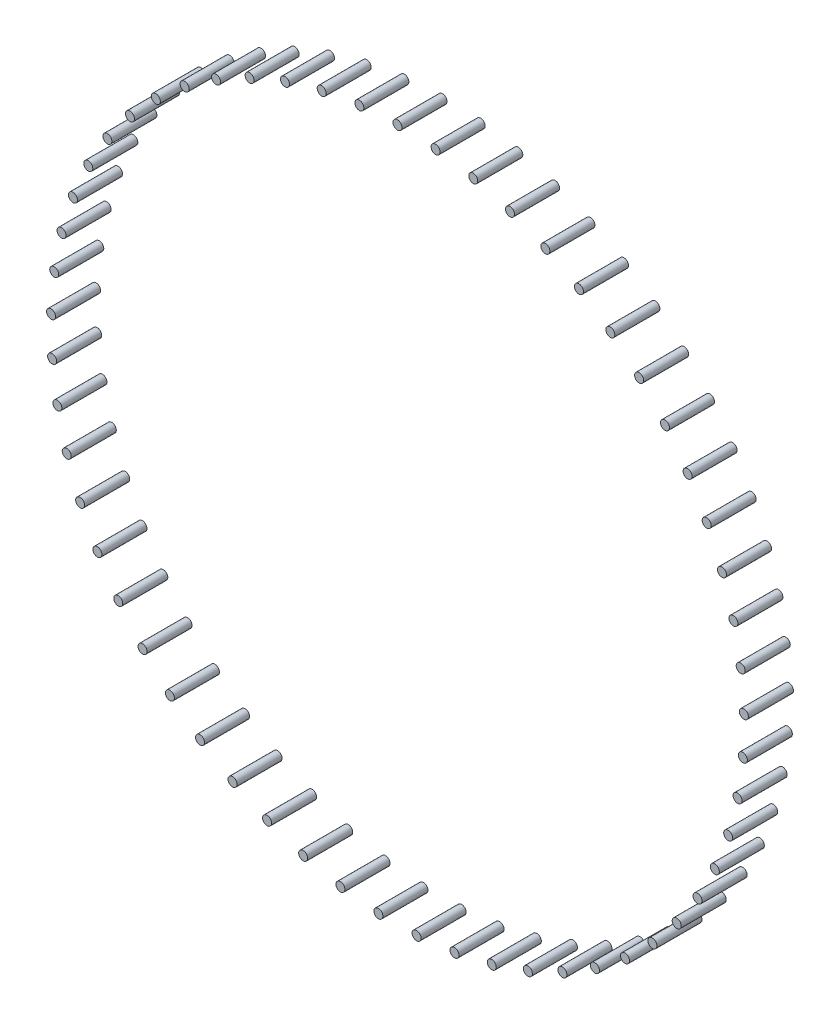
SolidWorks part; units mm, degrees
ref_plane "Plan de face" through (0, 0, 0) normal (0, 0, 1) x (1, 0, 0)
ref_plane "Plan de dessus" through (0, 0, 0) normal (0, 1, 0) x (1, 0, 0)
ref_plane "Plan de droite" through (0, 0, 0) normal (1, 0, 0) x (0, 0, -1)
sketch "Esquisse1" plane through (0, 0, 0) normal (0, 0, 1) x (1, 0, 0)
  line L0 (0, 0) -> (0, 174.6605) construction
  line L1 (0, 0) -> (19.2141, 173.6004) construction
  line L2 (0, 0) -> (38.1949, 170.4331) construction
  line L3 (0, 0) -> (56.7122, 165.1969) construction
  line L4 (0, 0) -> (74.541, 157.9555) construction
  line L5 (0, 0) -> (91.465, 148.7967) construction
  line L6 (0, 0) -> (107.2787, 137.8317) construction
  line L7 (0, 0) -> (121.7902, 125.1936) construction
  line L8 (0, 0) -> (134.8233, 111.0358) construction
  line L9 (0, 0) -> (146.2199, 95.5302) construction
  line L10 (0, 0) -> (155.8416, 78.865) construction
  line L11 (0, 0) -> (163.5715, 61.2425) construction
  line L12 (0, 0) -> (169.3159, 42.8766) construction
  line L13 (0, 0) -> (173.0051, 23.9902) construction
  line L14 (0, 0) -> (174.5942, 4.8127) construction
  line L15 (0, 0) -> (174.0639, -14.4233) construction
  line L16 (0, 0) -> (171.4208, -33.4843) construction
  line L17 (0, 0) -> (166.6969, -52.1387) construction
  line L18 (0, 0) -> (159.9494, -70.1603) construction
  line L19 (0, 0) -> (151.2604, -87.3303) construction
  line L20 (0, 0) -> (140.7353, -103.4401) construction
  line L21 (0, 0) -> (128.5019, -118.2943) construction
  line L22 (0, 0) -> (114.7086, -131.7126) construction
  line L23 (0, 0) -> (99.523, -143.5321) construction
  line L24 (0, 0) -> (83.1292, -153.6093) construction
  line L25 (0, 0) -> (65.7264, -161.8219) construction
  line L26 (0, 0) -> (47.5257, -168.0702) construction
  line L27 (0, 0) -> (28.7482, -172.2784) construction
  line L28 (0, 0) -> (9.6217, -174.3953) construction
  line L29 (0, 0) -> (-9.6217, -174.3953) construction
  line L30 (0, 0) -> (-28.7482, -172.2784) construction
  line L31 (0, 0) -> (-47.5257, -168.0702) construction
  line L32 (0, 0) -> (-65.7264, -161.8219) construction
  line L33 (0, 0) -> (-83.1292, -153.6093) construction
  line L34 (0, 0) -> (-99.523, -143.5321) construction
  line L35 (0, 0) -> (-114.7086, -131.7126) construction
  line L36 (0, 0) -> (-128.5019, -118.2943) construction
  line L37 (0, 0) -> (-140.7353, -103.4401) construction
  line L38 (0, 0) -> (-151.2604, -87.3302) construction
  line L39 (0, 0) -> (-159.9494, -70.1603) construction
  line L40 (0, 0) -> (-166.6969, -52.1387) construction
  line L41 (0, 0) -> (-171.4208, -33.4843) construction
  line L42 (0, 0) -> (-174.0639, -14.4233) construction
  line L43 (0, 0) -> (-174.5942, 4.8127) construction
  line L44 (0, 0) -> (-173.0051, 23.9902) construction
  line L45 (0, 0) -> (-169.3159, 42.8766) construction
  line L46 (0, 0) -> (-163.5715, 61.2425) construction
  line L47 (0, 0) -> (-155.8416, 78.865) construction
  line L48 (0, 0) -> (-146.2199, 95.5302) construction
  line L49 (0, 0) -> (-134.8233, 111.0358) construction
  line L50 (0, 0) -> (-121.7902, 125.1936) construction
  line L51 (0, 0) -> (-107.2787, 137.8317) construction
  line L52 (0, 0) -> (-91.465, 148.7967) construction
  line L53 (0, 0) -> (-74.541, 157.9555) construction
  line L54 (0, 0) -> (-56.7122, 165.1969) construction
  line L55 (0, 0) -> (-38.1949, 170.4331) construction
  line L56 (0, 0) -> (-19.2141, 173.6004) construction
  circle A0 centre (0, 0) radius 174.6605 construction
  circle A1 centre (-83.1292, -153.6093) radius 2.269
  circle A2 centre (-99.523, -143.5321) radius 2.269
  circle A3 centre (-114.7086, -131.7126) radius 2.269
  circle A4 centre (-128.5019, -118.2943) radius 2.269
  circle A5 centre (-140.7353, -103.4401) radius 2.269
  circle A6 centre (-151.2604, -87.3303) radius 2.269
  circle A7 centre (-159.9494, -70.1603) radius 2.269
  circle A8 centre (-166.6969, -52.1387) radius 2.269
  circle A9 centre (-171.4208, -33.4843) radius 2.269
  circle A10 centre (-174.0639, -14.4233) radius 2.269
  circle A11 centre (-174.5942, 4.8127) radius 2.269
  circle A12 centre (-173.0051, 23.9902) radius 2.269
  circle A13 centre (-169.3159, 42.8766) radius 2.269
  circle A14 centre (-163.5715, 61.2425) radius 2.269
  circle A15 centre (-155.8416, 78.865) radius 2.269
  circle A16 centre (-146.2199, 95.5302) radius 2.269
  circle A17 centre (-134.8233, 111.0358) radius 2.269
  circle A18 centre (-121.7902, 125.1936) radius 2.269
  circle A19 centre (-107.2787, 137.8317) radius 2.269
  circle A20 centre (-91.465, 148.7967) radius 2.269
  circle A21 centre (-74.541, 157.9555) radius 2.269
  circle A22 centre (-56.7122, 165.1969) radius 2.269
  circle A23 centre (-38.1949, 170.4331) radius 2.269
  circle A24 centre (-19.2141, 173.6004) radius 2.269
  circle A25 centre (0, 174.6605) radius 2.269
  circle A26 centre (19.2141, 173.6004) radius 2.269
  circle A27 centre (38.1949, 170.4331) radius 2.269
  circle A28 centre (56.7122, 165.1969) radius 2.269
  circle A29 centre (74.541, 157.9555) radius 2.269
  circle A30 centre (91.465, 148.7967) radius 2.269
  circle A31 centre (107.2787, 137.8317) radius 2.269
  circle A32 centre (121.7902, 125.1936) radius 2.269
  circle A33 centre (134.8233, 111.0358) radius 2.269
  circle A34 centre (146.2199, 95.5302) radius 2.269
  circle A35 centre (155.8416, 78.865) radius 2.269
  circle A36 centre (163.5715, 61.2425) radius 2.269
  circle A37 centre (169.3159, 42.8766) radius 2.269
  circle A38 centre (173.0051, 23.9902) radius 2.269
  circle A39 centre (174.5942, 4.8127) radius 2.269
  circle A40 centre (174.0639, -14.4233) radius 2.269
  circle A41 centre (171.4208, -33.4843) radius 2.269
  circle A42 centre (166.6969, -52.1387) radius 2.269
  circle A43 centre (159.9494, -70.1603) radius 2.269
  circle A44 centre (151.2604, -87.3302) radius 2.269
  circle A45 centre (140.7353, -103.4401) radius 2.269
  circle A46 centre (128.5019, -118.2943) radius 2.269
  circle A47 centre (114.7086, -131.7126) radius 2.269
  circle A48 centre (99.523, -143.5321) radius 2.269
  circle A49 centre (83.1292, -153.6093) radius 2.269
  circle A50 centre (65.7264, -161.8219) radius 2.269
  circle A51 centre (47.5257, -168.0702) radius 2.269
  circle A52 centre (28.7482, -172.2784) radius 2.269
  circle A53 centre (9.6217, -174.3953) radius 2.269
  circle A54 centre (-9.6217, -174.3953) radius 2.269
  circle A55 centre (-28.7482, -172.2784) radius 2.269
  circle A56 centre (-47.5257, -168.0702) radius 2.269
  circle A57 centre (-65.7264, -161.8219) radius 2.269
  dimension "D1" = 349.321
  dimension "D3" = 4.538
  dimension "D2" = 57
  dimension "D4" = 57
extrude "Boss.-Extru.1" add sketch "Esquisse1" along normal blind 22.71
